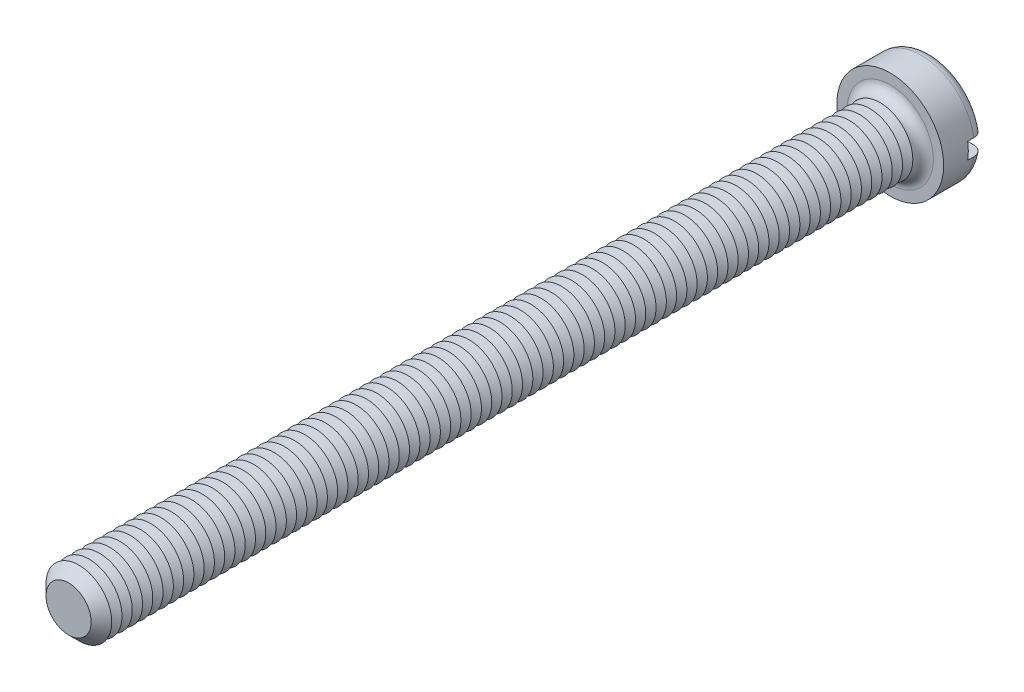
SolidWorks part; units mm, degrees
ref_plane "Front Plane" through (0, 0, 0) normal (0, 0, 1) x (1, 0, 0)
ref_plane "Top Plane" through (0, 0, 0) normal (0, 1, 0) x (1, 0, 0)
ref_plane "Right Plane" through (0, 0, 0) normal (1, 0, 0) x (0, 0, -1)
sketch "Sketch3" plane through (0, 0, 0) normal (0, 0, 1) x (1, 0, 0)
  circle A0 centre (0, 0) radius 6.5
  dimension "D1" = 13
extrude "Boss-Extrude2" add sketch "Sketch3" against normal blind 5
sketch "Sketch4" plane through (0, 0, 0) normal (0, 0, 1) x (1, 0, 0)
  circle A0 centre (0, 0) radius 4
  dimension "D1" = 8
extrude "Boss-Extrude3" add sketch "Sketch4" along normal blind 100
fillet "Fillet1" radius 1.25 2 edges at (6.5, 0, -5) (4, 0, 0)
chamfer "Chamfer1" distance 1.25 angle 45 1 edges at (4, 0, 100)
sketch "Sketch5" plane through (0, 0, 0) normal (1, 0, 0) x (0, 0, -1)
  line L0 (1.6944, 0) -> (-7.6738, 0) construction
sketch "Sketch6" plane through (0, 0, 0) normal (1, 0, 0) x (0, 0, -1)
  line L0 (-1.25, 4) -> (-1.875, 2.9175)
  line L1 (-1.875, 2.9175) -> (-2.5, 4)
  line L2 (-1.25, 4) -> (-98.75, 4) construction
  line L3 (-2.5, 4) -> (-1.25, 4)
  dimension "D1" = 1.25
revolve "Cut-Revolve1" cut sketch "Sketch6" angle 360 about L0
pattern_linear "LPattern1" count 78 spacing 1.25 along (0, 0, 1) of "Cut-Revolve1"
sketch "Sketch8" plane through (0, 0, -5) normal (0, 0, -1) x (-1, 0, 0)
  line L1 (6.5, -1) -> (-6.5, -1)
  line L2 (6.5, -1) -> (6.5, 1)
  line L3 (6.5, 1) -> (-6.5, 1)
  line L4 (-6.5, -1) -> (-6.5, 1)
  line L5 (6.5, -1) -> (-6.5, 1) construction
  line L6 (6.5, 1) -> (-6.5, -1) construction
  point P0 (0, 0)
  dimension "D1" = 13
  dimension "D2" = 2
extrude "Cut-Extrude1" cut sketch "Sketch8" against normal blind 2
